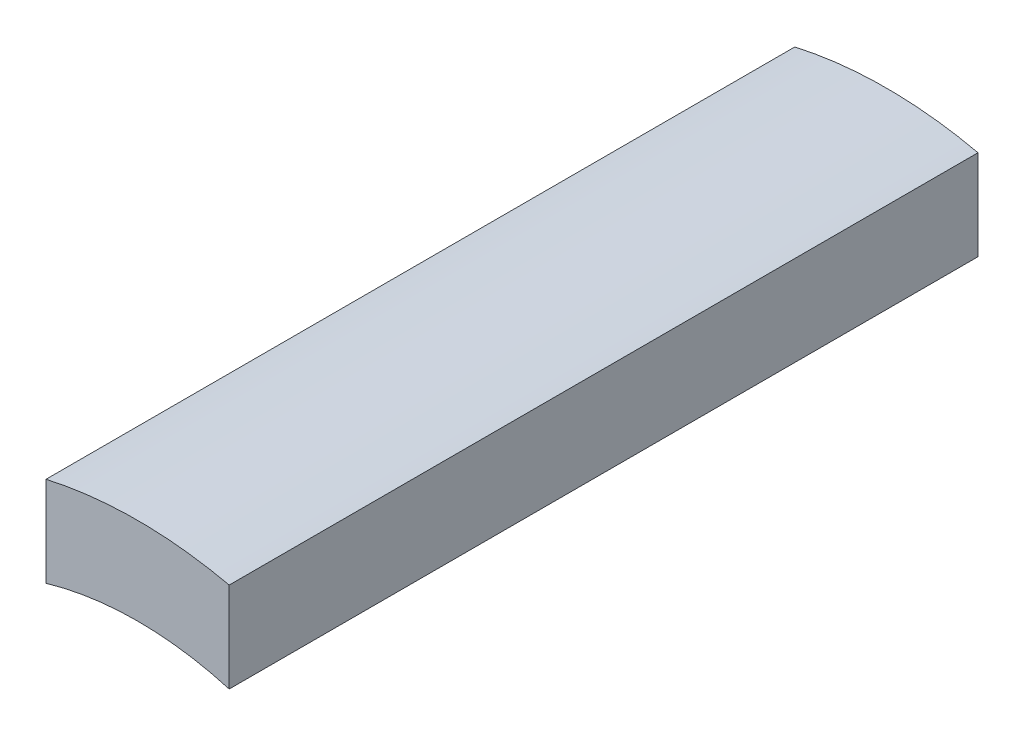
SolidWorks part; units mm, degrees
ref_plane "Přední rovina" through (0, 0, 0) normal (0, 0, 1) x (1, 0, 0)
ref_plane "Horní rovina" through (0, 0, 0) normal (0, 1, 0) x (1, 0, 0)
ref_plane "Pravá rovina" through (0, 0, 0) normal (1, 0, 0) x (0, 0, -1)
sketch "Skica1" plane through (0, 0, 0) normal (0, 0, 1) x (1, 0, 0)
  line L0 (0, 0) -> (0, 35.7173) construction
  line L1 (0, 0) -> (35.7173, 0) construction
  line L3 (-6.3, 21.6) -> (-6.3, 27.795)
  line L4 (6.3, 21.6) -> (6.3, 27.795)
  arc A0 (6.3, 27.795) -> (-6.3, 27.795) centre (0, 0) ccw
  arc A1 (6.3, 21.6) -> (-6.3, 21.6) centre (0, 0) ccw
  point P3 (-6.3, 24.6975)
  point P5 (6.3, 24.6975)
  dimension "D1" = 45
  dimension "D2" = 6
  dimension "D3" = 12.6
extrude "Přidat vysunutím1" add sketch "Skica1" along normal blind 51.5
